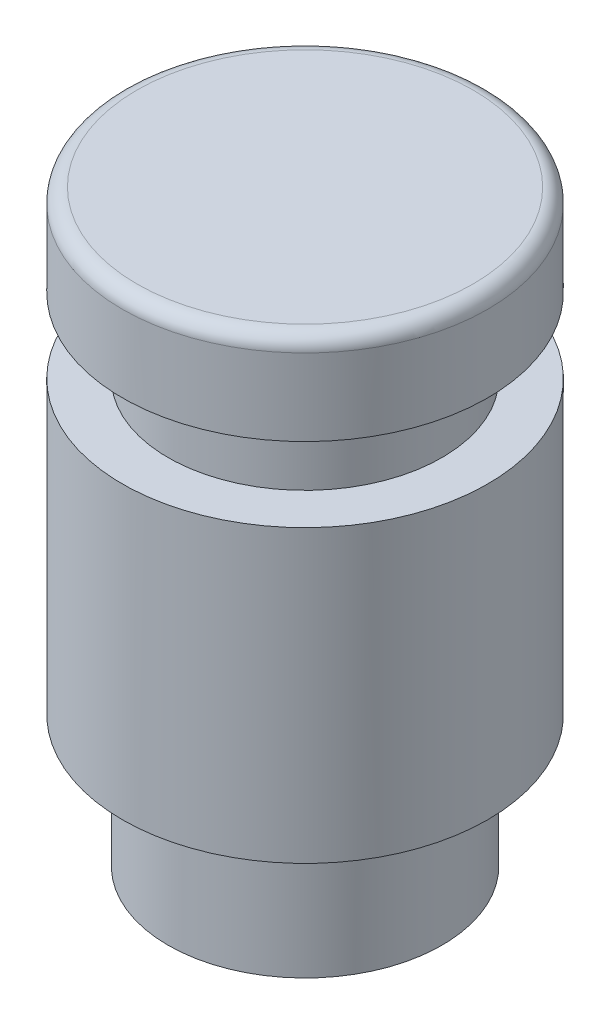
SolidWorks part; units mm, degrees
ref_plane "Front Plane" through (0, 0, 0) normal (0, 0, 1) x (1, 0, 0)
ref_plane "Top Plane" through (0, 0, 0) normal (0, 1, 0) x (1, 0, 0)
ref_plane "Right Plane" through (0, 0, 0) normal (1, 0, 0) x (0, 0, -1)
sketch "Sketch1" plane through (0, 0, 0) normal (0, 1, 0) x (1, 0, 0)
  circle A0 centre (0, 0) radius 3.175
  dimension "D1" = 6.35
extrude "Boss-Extrude1" add sketch "Sketch1" along normal blind 7.9375
sketch "Sketch3" plane through (0, 0, 0) normal (1, 0, 0) x (0, 0, -1)
  line L0 (0, 0) -> (0, 8.2345) construction
  line L1 (3.175, 0) -> (3.175, 7.9375) construction
  line L2 (3.175, 6.35) -> (2.3813, 6.35)
  line L3 (3.175, 6.35) -> (3.175, 5.0546)
  line L4 (3.175, 5.0546) -> (2.3813, 5.0546)
  line L5 (2.3813, 6.35) -> (2.3813, 5.0546)
  line L6 (3.175, 7.9375) -> (-3.175, 7.9375) construction
  dimension "D1" = 4.7625
  dimension "D2" = 1.5875
  dimension "D3" = 1.2954
revolve "Cut-Revolve1" cut sketch "Sketch3" angle 360 about L0
sketch "Sketch4" plane through (0, 0, 0) normal (0, -1, 0) x (1, 0, 0)
  circle A0 centre (0, 0) radius 2.3813
  dimension "D1" = 4.7625
extrude "Boss-Extrude2" add sketch "Sketch4" along normal blind 2.286
fillet "Fillet2" radius 0.254 1 edges at (0, 7.9375, 3.175)
